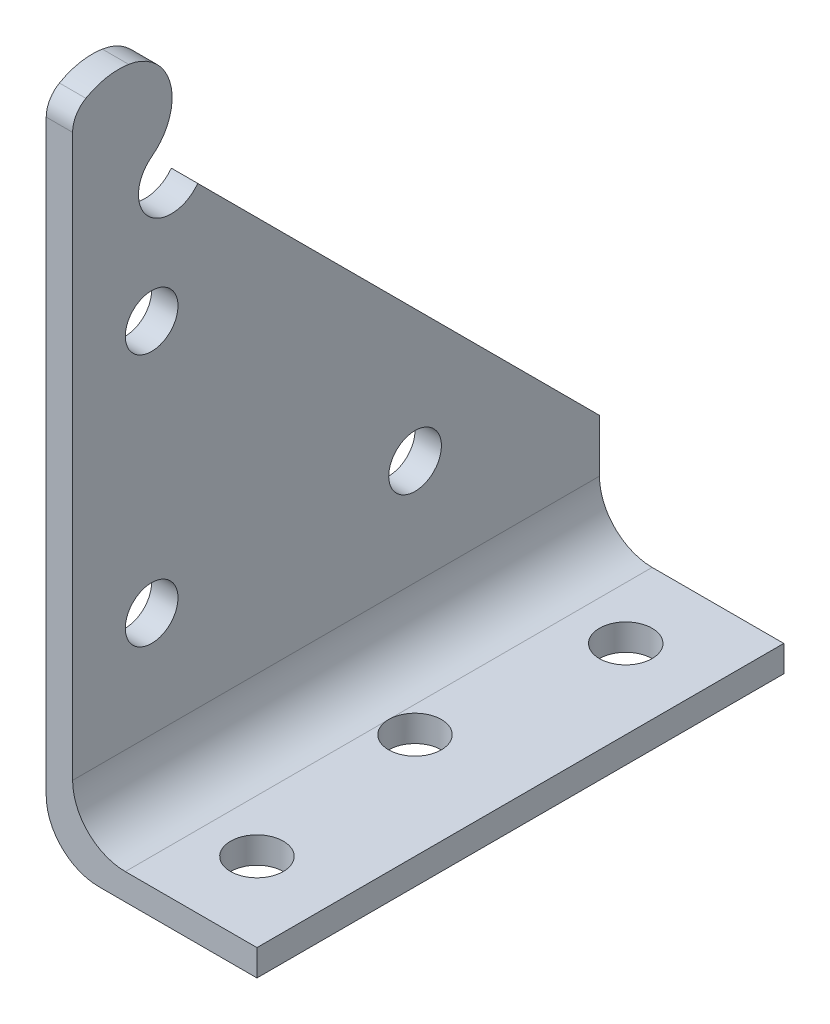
SolidWorks part; units mm, degrees
ref_plane "Front Plane" through (0, 0, 0) normal (0, 0, 1) x (1, 0, 0)
ref_plane "Top Plane" through (0, 0, 0) normal (0, 1, 0) x (1, 0, 0)
ref_plane "Right Plane" through (0, 0, 0) normal (1, 0, 0) x (0, 0, -1)
sketch "Sketch1" plane through (0, 0, 0) normal (0, 0, 1) x (1, 0, 0)
  line L0 (0, 0) -> (0, 81.28)
  line L1 (0, 81.28) -> (3.1826, 81.28)
  line L2 (3.1826, 81.28) -> (3.1826, 3.175)
  line L3 (3.1826, 3.175) -> (25.4, 3.175)
  line L4 (25.4, 3.175) -> (25.4, 0)
  line L5 (25.4, 0) -> (0, 0)
  dimension "D1" = 3.175
  dimension "D2" = 3.1826
  dimension "D3" = 81.28
  dimension "D4" = 25.4
extrude "Boss-Extrude1" add sketch "Sketch1" along normal mid plane 63.5
fillet "Fillet1" radius 6.35 1 edges at (0, 0, 0)
fillet "Fillet2" radius 6.35 1 edges at (3.1826, 3.175, 0)
sketch "Sketch2" plane through (3.1826, 0, 0) normal (1, 0, 0) x (0, 0, -1)
  line L0 (-31.75, 0) -> (31.75, 0) construction
  line L1 (-31.75, 9.525) -> (-31.75, 81.28) construction
  line L2 (31.75, 15.875) -> (-16.6695, 64.2945)
  line L3 (-31.75, 81.28) -> (31.75, 81.28) construction
  line L4 (31.75, 9.525) -> (31.75, 81.28) construction
  line L7 (-31.75, 3.175) -> (31.75, 3.175) construction
  line L8 (-16.6695, 64.2945) -> (-31.75, 79.375) construction
  line L9 (-31.75, 9.525) -> (31.75, 9.525) construction
  circle A0 centre (-22.225, 22.225) radius 3.175
  circle A1 centre (9.525, 22.225) radius 3.175
  circle A2 centre (-22.225, 52.705) radius 3.175
  arc A3 (-22.2255, 69.8505) -> (-16.6695, 64.2945) centre (-19.845, 66.675) ccw
  arc A4 (-22.2255, 69.8505) -> (-24.9925, 80.8837) centre (-25.9255, 74.7862) ccw
  arc A5 (-26.195, 80.9752) -> (-24.9925, 80.8837) centre (-26.195, 73.025) cw
  arc A6 (-26.195, 80.9752) -> (-30.154, 79.9194) centre (-26.195, 73.025) ccw
  arc A7 (-30.154, 79.9194) -> (-31.75, 77.1624) centre (-28.5709, 77.1624) ccw
  point P19 (-26.195, 73.025)
  point P24 (-26.195, 80.9752)
  dimension "D1" = 6.35
  dimension "D9" = 7.9375
  dimension "D13" = 80.9752
  dimension "D15" = 3.1791
  dimension "D2" = 22.225
  dimension "D3" = 9.525
  dimension "D4" = 31.75
  dimension "D5" = 30.48
  dimension "D6" = 66.675
  dimension "D7" = 45
  dimension "D8" = 12.7
  dimension "D10" = 11.905
  dimension "D11" = 5.555
  dimension "D12" = 73.025
extrude "Cut-Extrude1" cut sketch "Sketch2" against normal through all contours L8 L2 A7 A6 A5 A4 M3 M4 M1 | A3 L8 | A7 L8 M1 | A2 | A0 | A1
sketch "Sketch3" plane through (0, 3.175, 0) normal (0, 1, 0) x (1, 0, 0)
  line L0 (25.4, -31.75) -> (25.4, 31.75) construction
  line L1 (25.4, -31.75) -> (9.5326, -31.75) construction
  line L2 (25.4, 31.75) -> (9.5326, 31.75) construction
  circle A0 centre (15.875, -22.225) radius 3.175
  circle A1 centre (12.7, 0) radius 3.175
  circle A2 centre (15.875, 22.225) radius 3.175
  dimension "D1" = 6.35
  dimension "D2" = 9.525
  dimension "D3" = 12.7
  dimension "D4" = 9.525
  dimension "D5" = 31.75
  dimension "D6" = 9.525
extrude "Cut-Extrude2" cut sketch "Sketch3" against normal through all
